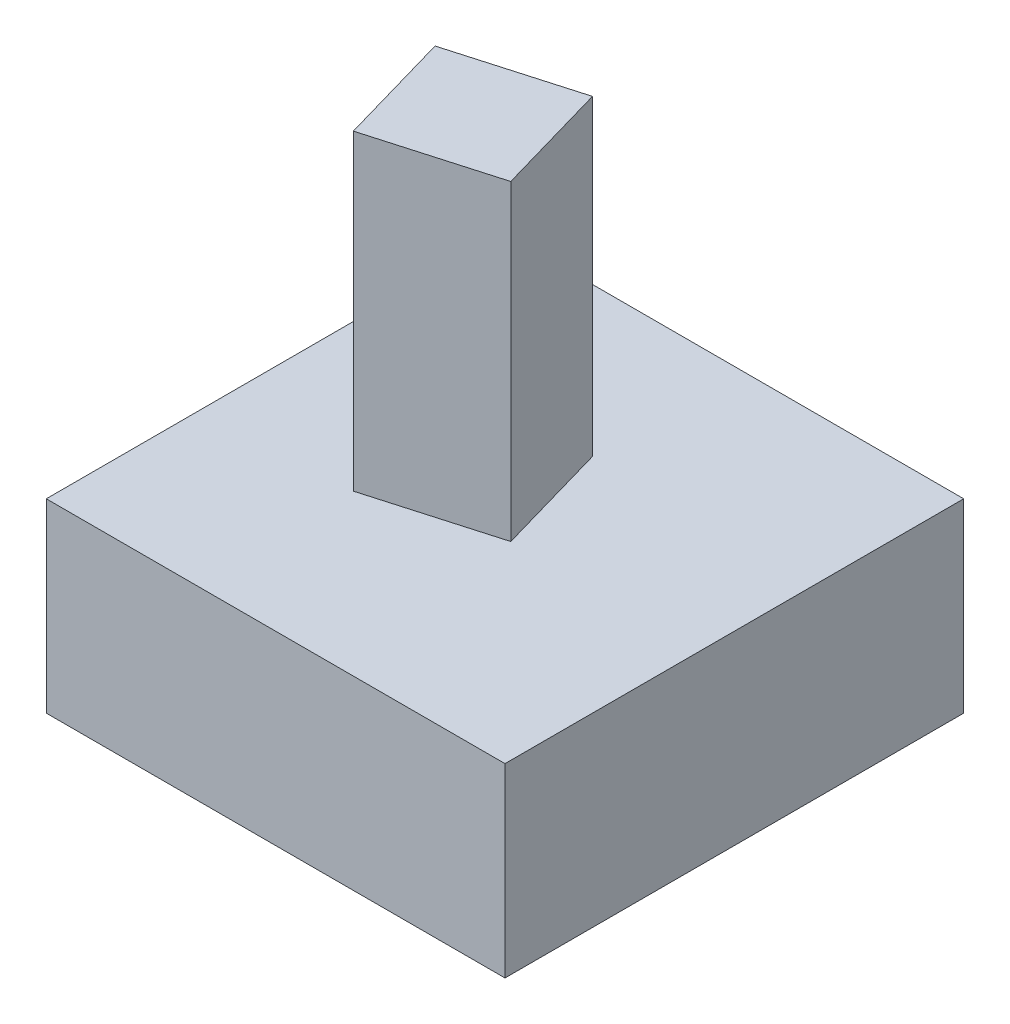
SolidWorks part; units mm, degrees
ref_plane "Front Plane" through (0, 0, 0) normal (0, 0, 1) x (1, 0, 0)
ref_plane "Top Plane" through (0, 0, 0) normal (0, 1, 0) x (1, 0, 0)
ref_plane "Right Plane" through (0, 0, 0) normal (1, 0, 0) x (0, 0, -1)
sketch "Sketch1" plane through (0, 0, 0) normal (0, 1, 0) x (1, 0, 0)
  line L0 (48.7636, -48.7636) -> (-48.7636, 48.7636) construction
  line L1 (-48.7636, 48.7636) -> (48.7636, 48.7636)
  line L2 (-48.7636, 48.7636) -> (-48.7636, -48.7636)
  line L3 (-48.7636, -48.7636) -> (48.7636, -48.7636)
  line L4 (48.7636, 48.7636) -> (48.7636, -48.7636)
extrude "Extrude1" add sketch "Sketch1" along normal blind 39.4736
sketch "Sketch2" plane through (-8.0112, 39.4736, -1.1917) normal (0, 1, 0) x (-0.9613, 0, 0.2756)
  line L0 (-13.5286, 12.6672) -> (13.5286, -12.6672) construction
  line L1 (-13.5286, 12.6672) -> (13.5286, 12.6672)
  line L2 (-13.5286, 12.6672) -> (-13.5286, -12.6672)
  line L3 (-13.5286, -12.6672) -> (13.5286, -12.6672)
  line L4 (13.5286, 12.6672) -> (13.5286, -12.6672)
extrude "Extrude2" add sketch "Sketch2" along normal blind 66.2965
